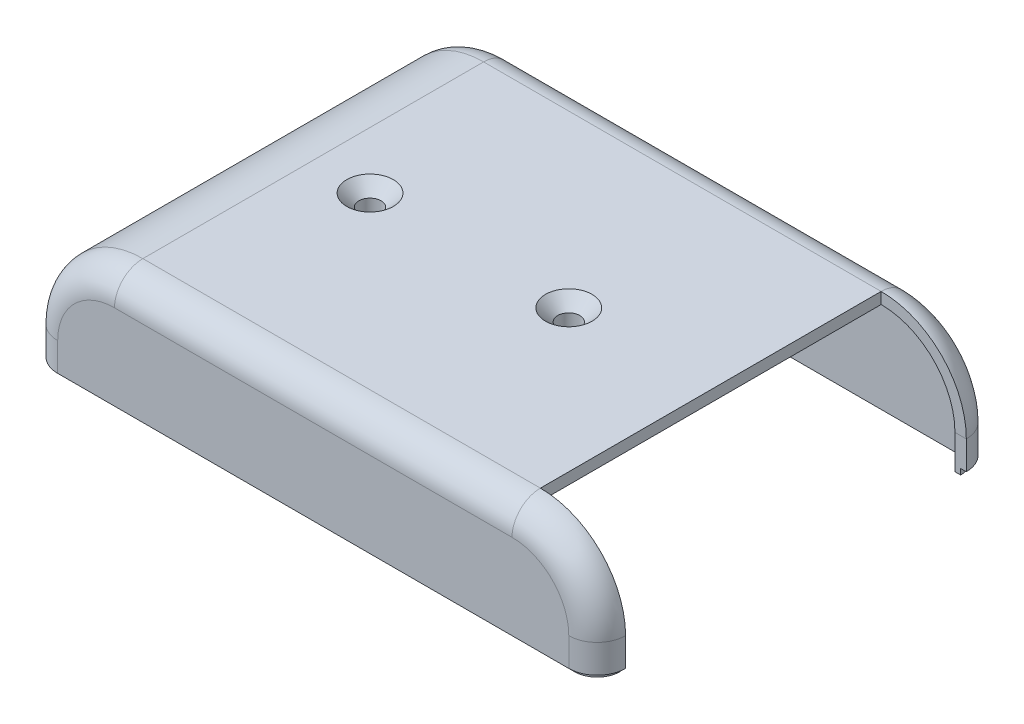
SolidWorks part; units mm, degrees
ref_plane "Front Plane" through (0, 0, 0) normal (0, 0, 1) x (1, 0, 0)
ref_plane "Top Plane" through (0, 0, 0) normal (0, 1, 0) x (1, 0, 0)
ref_plane "Right Plane" through (0, 0, 0) normal (1, 0, 0) x (0, 0, -1)
sketch "Sketch1" plane through (0, 0, 0) normal (0, 1, 0) x (1, 0, 0)
  line L1 (0, 0) -> (100, 0)
  line L2 (0, 0) -> (0, 70)
  line L3 (0, 70) -> (100, 70)
  line L4 (100, 0) -> (100, 70)
  dimension "D1" = 100
  dimension "D2" = 70
extrude "Extrude1" add sketch "Sketch1" along normal blind 20
fillet "Fillet1" radius 15 2 edges at (100, 20, -35) (0, 20, -35)
fillet "Fillet3" radius 5 10 edges at (0, 2.5, -70) (4.3934, 15.6066, -70) (50, 20, -70) (95.6066, 15.6066, -70) (100, 2.5, 0) (95.6066, 15.6066, 0) (50, 20, 0) (4.3934, 15.6066, 0) (100, 2.5, -70) (0, 2.5, 0)
shell "Shell1" thickness 2
ref_plane "Plane1" through (0, 5, 0) normal (0, 1, 0) x (-1, 0, 0)
sketch "Sketch2" plane through (0, 5, 0) normal (0, 1, 0) x (-1, 0, 0)
  line L0 (-15, -70) -> (-85, -70) construction
  line L1 (0, -5) -> (0, -65) construction
  line L2 (0, -65) -> (0, -5) construction
  circle A0 centre (-60, -35) radius 3
  circle A1 centre (-25, -35) radius 3
  point P8 (0, -35)
  dimension "D1" = 6
  dimension "D2" = 35
  dimension "D3" = 25
  dimension "D4" = 60
extrude "Extrude2" add sketch "Sketch2" along normal up to next draft 5
hole_wizard "CSK for M3.5 Flat Head Machine Screw5" positions "3DSketch5" profile "Sketch7" countersink size "M3.5" standard "Ansi Metric"
sketch3d "3DSketch5"
  circle A0 centre (25, 18, -35) radius 4.1374 construction
  circle A1 centre (60, 18, -35) radius 4.1374 construction
  point P0 (25, 20, -35)
  point P2 (60, 20, -35)
  point P8 (25, 13.8626, -35)
  point P11 (60, 13.8626, -35)
sketch "Sketch7" plane through (25, 20, -35) normal (1, 0, 0) x (0, 0, 1)
  line L0 (0, 0) -> (0, 20)
  line L1 (0, 20) -> (1.95, 20)
  line L2 (1.95, 20) -> (1.95, 2.15)
  line L3 (1.95, 2.15) -> (4.1, 0)
  line L5 (4.1, 0) -> (0, 0)
  line L6 (-1.95, 2.15) -> (-4.1, 0) construction
  line L11 (0, -6.35) -> (0, 107.95) construction
  dimension "Thru Hole Dia." = 3.9
  dimension "Thru Hole Depth" = 20
  dimension "Near C'Sink Dia." = 8.2
  dimension "Near C'Sink Angle" = 90
fillet "Fillet17" radius 1 2 edges at (25, 18, -39.1374) (60, 18, -39.1374)
sketch "Sketch9" plane through (0, 0, 0) normal (0, -1, 0) x (1, 0, 0)
  line L0 (5, -2) -> (95, -2) construction
  line L1 (95, -68) -> (5, -68) construction
  line L2 (2, -65) -> (2, -5) construction
  line L3 (5, -2) -> (95, -2)
  line L4 (95, -68) -> (5, -68)
  line L5 (2, -65) -> (2, -5)
  arc A0 (98, -5) -> (95, -2) centre (95, -5) ccw construction
  arc A1 (5, -2) -> (2, -5) centre (5, -5) ccw construction
  arc A2 (95, -68) -> (98, -65) centre (95, -65) ccw construction
  arc A3 (2, -65) -> (5, -68) centre (5, -65) ccw construction
  arc A4 (98, -5) -> (95, -2) centre (95, -5) ccw
  arc A5 (5, -2) -> (2, -5) centre (5, -5) ccw
  arc A6 (95, -68) -> (98, -65) centre (95, -65) ccw
  arc A7 (2, -65) -> (5, -68) centre (5, -65) ccw
extrude "Extrude-Thin1" add sketch "Sketch9" along normal blind 1 thin
